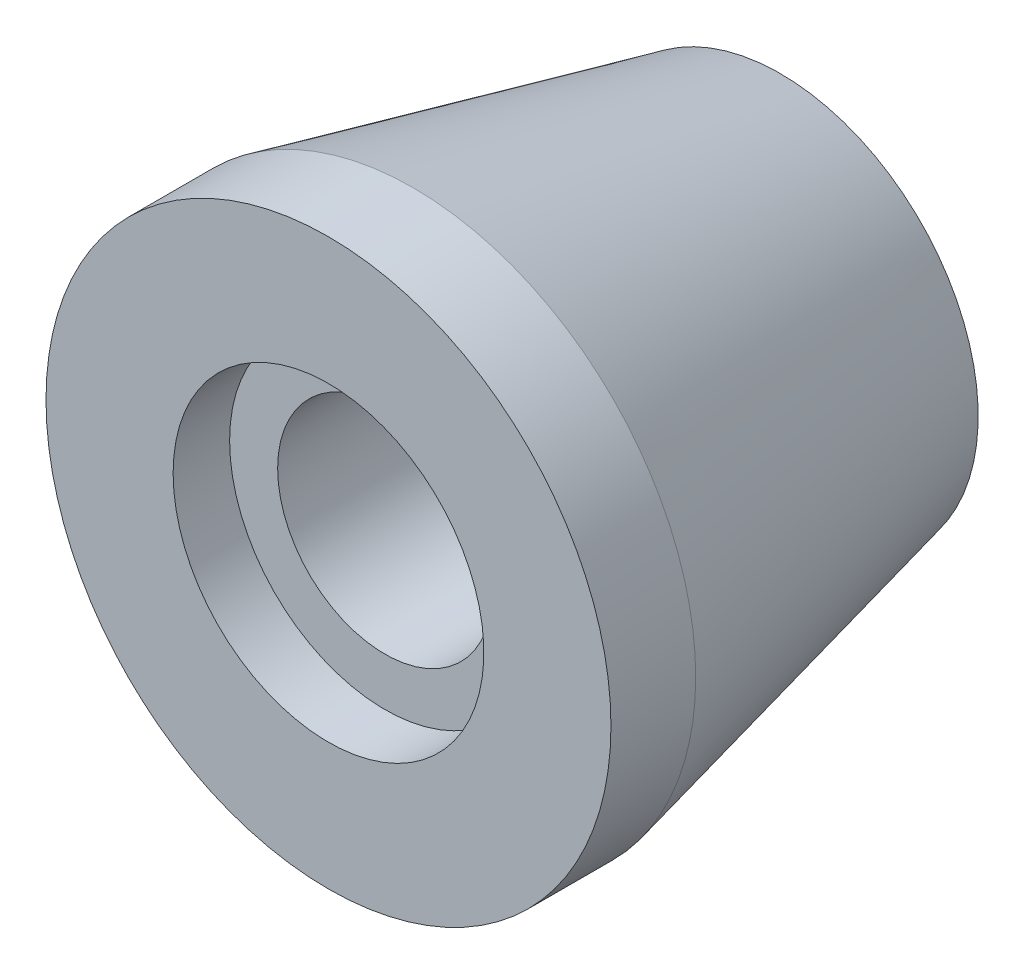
SolidWorks part; units mm, degrees
ref_plane "Front Plane" through (0, 0, 0) normal (0, 0, 1) x (1, 0, 0)
ref_plane "Top Plane" through (0, 0, 0) normal (0, 1, 0) x (1, 0, 0)
ref_plane "Right Plane" through (0, 0, 0) normal (1, 0, 0) x (0, 0, -1)
sketch "Sketch3" plane through (0, 0, 0) normal (1, 0, 0) x (0, 0, -1)
  line L0 (0, 7) -> (0, 0) construction
  line L1 (0, 0) -> (-15.4387, 0) construction
  line L2 (0, 7) -> (0, 3.8)
  line L3 (0, 3.8) -> (-14, 3.8)
  line L4 (-14, 3.8) -> (-14, 5.5)
  line L5 (-14, 5.5) -> (-16, 5.5)
  line L6 (-16, 5.5) -> (-16, 10)
  line L7 (-16, 10) -> (-13, 10)
  line L8 (-13, 10) -> (0, 7)
  point P3 (0, 0)
  point P18 (0, 0)
  point P19 (0, 0)
  dimension "D3" = 2
  dimension "D4" = 16
revolve "Revolve1" add sketch "Sketch3" angle 360 about L1
